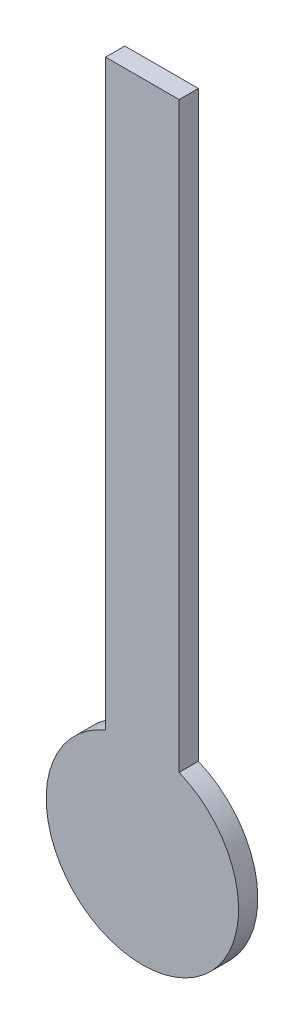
SolidWorks part; units mm, degrees
ref_plane "Ebene vorne" through (0, 0, 0) normal (0, 0, 1) x (1, 0, 0)
ref_plane "Ebene oben" through (0, 0, 0) normal (0, 1, 0) x (1, 0, 0)
ref_plane "Ebene rechts" through (0, 0, 0) normal (1, 0, 0) x (0, 0, -1)
sketch "Skizze1" plane through (0, 0, 0) normal (0, 0, 1) x (1, 0, 0)
  line L2 (-1.9123, 4.6199) -> (-1.9123, 34.9148)
  line L3 (-1.9123, 34.9148) -> (1.9095, 34.9148)
  line L4 (1.9095, 4.621) -> (1.9095, 34.9148)
  arc A0 (-1.9123, 4.6199) -> (1.9095, 4.621) centre (0, 0) ccw
  dimension "D1" = 10
extrude "Linear austragen1" add sketch "Skizze1" along normal blind 1
